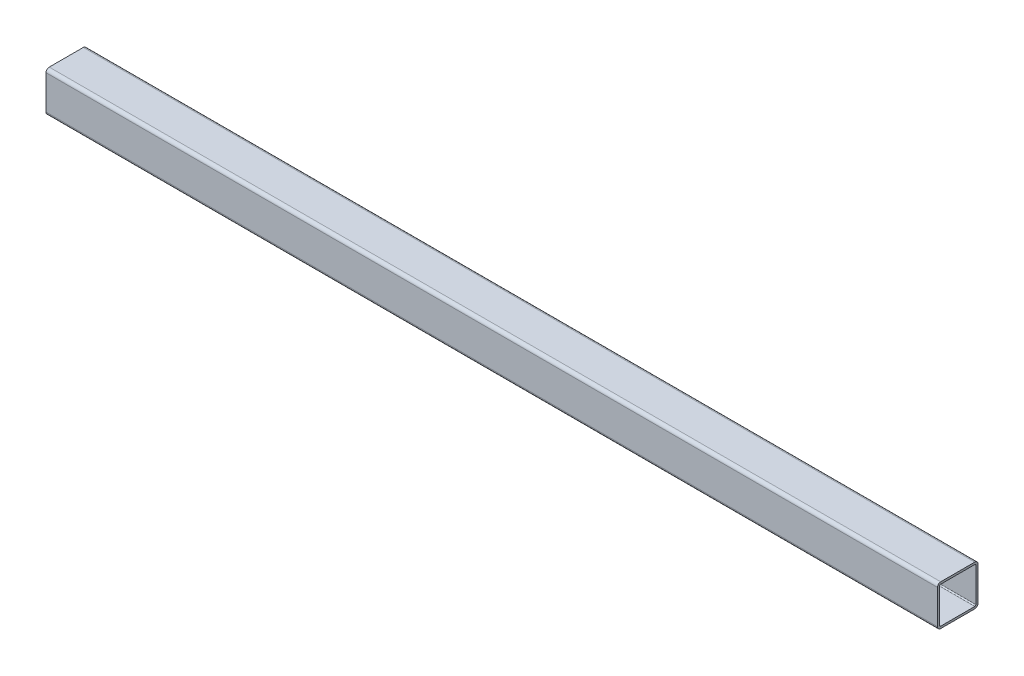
SolidWorks part; units mm, degrees
ref_plane "Front Plane" through (0, 0, 0) normal (0, 0, 1) x (1, 0, 0)
ref_plane "Top Plane" through (0, 0, 0) normal (0, 1, 0) x (1, 0, 0)
ref_plane "Right Plane" through (0, 0, 0) normal (1, 0, 0) x (0, 0, -1)
sketch "Sketch1" plane through (0, 0, 0) normal (1, 0, 0) x (0, 0, -1)
  line L0 (0, 2.54) -> (0, 29.21)
  line L1 (-2.54, 31.75) -> (-29.21, 31.75)
  line L2 (-31.75, 29.21) -> (-31.75, 2.54)
  line L3 (-29.21, 0) -> (-2.54, 0)
  line L4 (-1.651, 2.54) -> (-1.651, 29.21)
  line L5 (-2.54, 30.099) -> (-29.21, 30.099)
  line L6 (-30.099, 29.21) -> (-30.099, 2.54)
  line L7 (-29.21, 1.651) -> (-2.54, 1.651)
  arc A0 (-31.75, 2.54) -> (-29.21, 0) centre (-29.21, 2.54) ccw
  arc A1 (0, 2.54) -> (-2.54, 0) centre (-2.54, 2.54) cw
  arc A2 (0, 29.21) -> (-2.54, 31.75) centre (-2.54, 29.21) ccw
  arc A3 (-31.75, 29.21) -> (-29.21, 31.75) centre (-29.21, 29.21) cw
  arc A4 (-1.651, 29.21) -> (-2.54, 30.099) centre (-2.54, 29.21) ccw
  arc A5 (-30.099, 29.21) -> (-29.21, 30.099) centre (-29.21, 29.21) cw
  arc A6 (-30.099, 2.54) -> (-29.21, 1.651) centre (-29.21, 2.54) ccw
  arc A7 (-1.651, 2.54) -> (-2.54, 1.651) centre (-2.54, 2.54) cw
  point P12 (0, 0)
  point P15 (0, 31.75)
  point P18 (-31.75, 31.75)
  dimension "D3" = 2.54
  dimension "D1" = 31.75
  dimension "D2" = 31.75
  dimension "D4" = 1.651
extrude "Boss-Extrude1" add sketch "Sketch1" along normal blind 698.5
